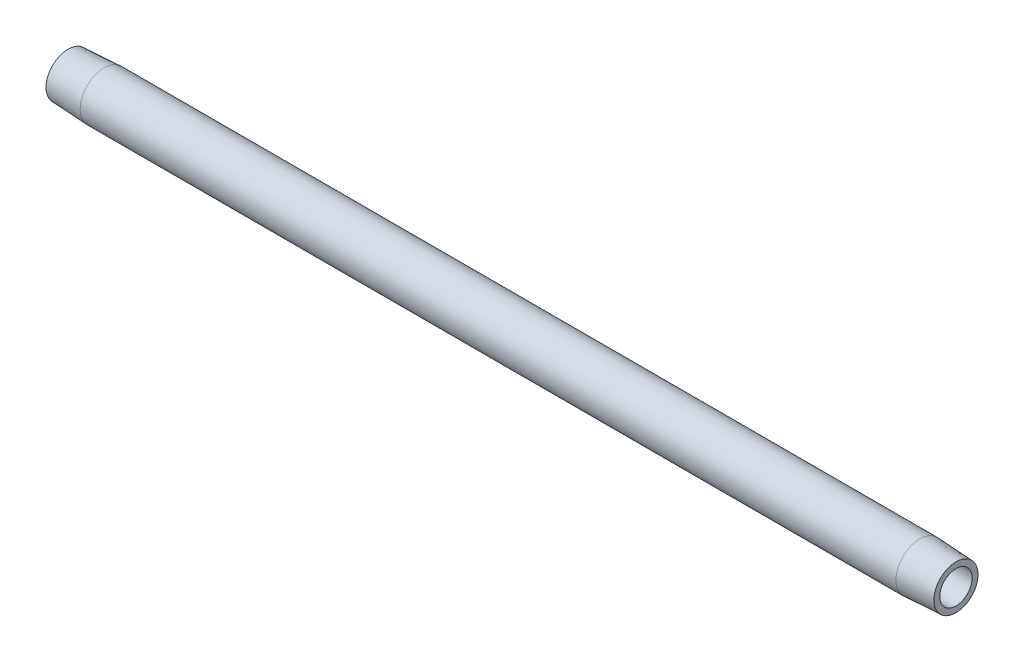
SolidWorks part; units mm, degrees
ref_plane "Front Plane" through (0, 0, 0) normal (0, 0, 1) x (1, 0, 0)
ref_plane "Top Plane" through (0, 0, 0) normal (0, 1, 0) x (1, 0, 0)
ref_plane "Right Plane" through (0, 0, 0) normal (1, 0, 0) x (0, 0, -1)
sketch "Sketch1" plane through (0, 0, 0) normal (0, 1, 0) x (1, 0, 0)
  line L6 (254, 4.6228) -> (0, 4.6228)
  line L7 (10.3124, 6.858) -> (0, 6.3175)
  line L8 (0, 6.3175) -> (0, 4.6228)
  line L9 (243.6876, 6.858) -> (10.3124, 6.858)
  line L10 (254, 6.3175) -> (243.6876, 6.858)
  line L11 (254, 4.6228) -> (254, 6.3175)
  line L12 (-6.376, 0) -> (49993.624, 0) construction
  dimension "D1" = 9.2456
  dimension "D2" = 13.716
  dimension "D3" = 3
  dimension "D4" = 3
  dimension "D5" = 254
  dimension "D6" = 10.3124
  dimension "D7" = 10.3124
revolve "Revolve1" add sketch "Sketch1" angle 360 about L12
